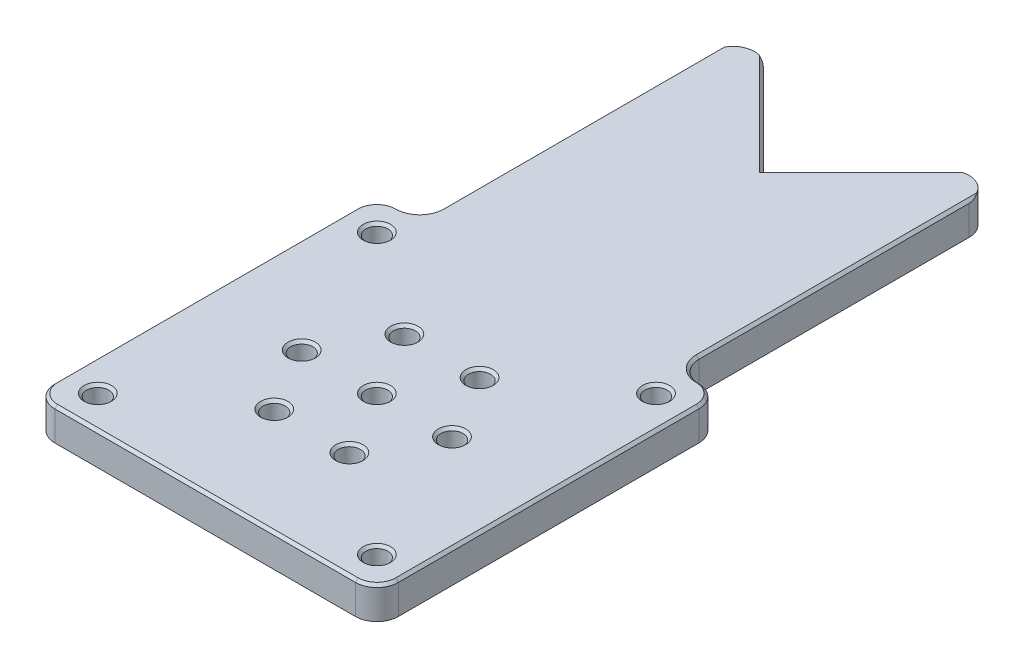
SolidWorks part; units mm, degrees
ref_plane "FRONT" through (0, 0, 0) normal (0, 0, 1) x (1, 0, 0)
ref_plane "TOP" through (0, 0, 0) normal (0, 1, 0) x (1, 0, 0)
ref_plane "RT-SIDE" through (0, 0, 0) normal (1, 0, 0) x (0, 0, -1)
sketch "Sketch1" plane through (0, 0, 0) normal (0, 0, 1) x (1, 0, 0)
  line L1 (0, 0) -> (203.2, 0)
  line L2 (0, 0) -> (0, 19.05)
  line L3 (0, 19.05) -> (203.2, 19.05)
  line L4 (203.2, 0) -> (203.2, 19.05)
  dimension "D1" = 203.2
  dimension "D2" = 19.05
extrude "Base-Extrude" add sketch "Sketch1" against normal blind 406.4
sketch "Sketch2" plane through (0, 19.05, 0) normal (0, 1, 0) x (-1, 0, 0)
  line L0 (-177.8, -406.4) -> (-177.8, -203.2)
  line L2 (-203.2, -406.4) -> (0, -406.4) construction
  line L3 (-177.8, -203.2) -> (-222.9556, -203.2)
  line L4 (-203.2, -406.4) -> (-203.2, 0) construction
  dimension "D1" = 25.4
  dimension "D2" = 203.2
extrude "Cut-Extrude2" cut sketch "Sketch2" against normal through all and the other way through all
sketch "Sketch3" plane through (0, 19.05, 0) normal (0, 1, 0) x (-1, 0, 0)
  line L0 (-25.4, -406.4) -> (-25.4, -203.2)
  line L1 (-177.8, -406.4) -> (0, -406.4) construction
  line L2 (-25.4, -203.2) -> (8.7892, -203.2)
  line L3 (0, -406.4) -> (0, 0) construction
  dimension "D1" = 25.4
  dimension "D2" = 203.2
extrude "Cut-Extrude3" cut sketch "Sketch3" against normal through all and the other way through all flip side to cut
sketch "Sketch5" plane through (0, 19.05, 0) normal (0, 1, 0) x (-1, 0, 0)
  line L0 (0, -203.2) -> (0, 0) construction
  line L1 (-203.2, 0) -> (0, 0) construction
  circle A0 centre (-19.05, -184.15) radius 6.5405
  circle A1 centre (-184.15, -184.15) radius 6.5405
  circle A2 centre (-184.15, -19.05) radius 6.5405
  circle A3 centre (-19.05, -19.05) radius 6.5405
  dimension "D1" = 13.081
  dimension "D4" = 13.081
  dimension "D7" = 13.081
  dimension "D10" = 13.081
  dimension "D2" = 19.05
  dimension "D3" = 184.15
  dimension "D5" = 165.1
  dimension "D6" = 184.15
  dimension "D8" = 165.1
  dimension "D9" = 165.1
  dimension "D11" = 165.1
  dimension "D12" = 165.1
extrude "Cut-Extrude5" cut sketch "Sketch5" against normal through all
sketch "Sketch6" plane through (0, 19.05, 0) normal (0, 1, 0) x (-1, 0, 0)
  line L0 (0, -203.2) -> (0, 0) construction
  line L1 (-203.2, 0) -> (0, 0) construction
  circle A0 centre (-101.6, -101.6) radius 6.5405
  dimension "D3" = 13.081
  dimension "D1" = 101.6
  dimension "D2" = 101.6
extrude "Cut-Extrude6" cut sketch "Sketch6" against normal through all
sketch "Sketch7" plane through (0, 19.05, 0) normal (0, 1, 0) x (-1, 0, 0)
  circle A0 centre (-146.05, -101.6) radius 6.5405
  circle A1 centre (-101.6, -101.6) radius 6.5405 construction
  dimension "D2" = 13.081
  dimension "D1" = 44.45
extrude "Cut-Extrude7" cut sketch "Sketch7" against normal through all
pattern_circular "CirPattern1" count 6 over 360 about axis through (101.6, 0, -101.6) along (0, 1, 0) of "Cut-Extrude7"
fillet "Fillet8" radius 12.7 10 edges at (190.5, 0, -203.2) (203.2, 9.525, -203.2) (190.5, 19.05, -203.2) (177.8, 9.525, -203.2) (0, 9.525, -203.2) (12.7, 19.05, -203.2) (25.4, 9.525, -203.2) (12.7, 0, -203.2) (203.2, 9.525, 0) (0, 9.525, 0)
sketch "Sketch9" plane through (0, 19.05, 0) normal (0, 1, 0) x (-1, 0, 0)
  line L0 (-25.4, -406.4) -> (-101.6, -330.2)
  line L1 (-101.6, -330.2) -> (-177.8, -406.4)
  line L2 (-177.8, -406.4) -> (-25.4, -406.4) construction
  dimension "D1" = 45
  dimension "D2" = 45
extrude "Cut-Extrude9" cut sketch "Sketch9" against normal through all and the other way through all
chamfer "Chamfer2" distance 1.5748 angle 45 24 edges at (21.6803, 19.05, -206.9197) (181.5197, 19.05, -206.9197) (139.7, 19.05, -368.3) (63.5, 19.05, -368.3) (19.05, 19.05, -177.6095) (184.15, 19.05, -177.6095) (184.15, 19.05, -12.5095) (19.05, 19.05, -12.5095) (101.6, 19.05, -95.0595) (146.05, 19.05, -95.0595) (129.4892, 19.05, -136.8246) (85.0392, 19.05, -143.3651) (57.15, 19.05, -108.1405) (73.7108, 19.05, -66.3754) (118.1608, 19.05, -59.8349) (101.6, 19.05, 0) (25.4, 19.05, -311.15) (0, 19.05, -101.6) (203.2, 19.05, -101.6) (177.8, 19.05, -311.15) (3.7197, 19.05, -199.4803) (199.4803, 19.05, -199.4803) (3.7197, 19.05, -3.7197) (199.4803, 19.05, -3.7197)
fillet "Fillet10" radius 12.7 2 edges at (25.4, 8.7376, -406.4) (177.8, 8.7376, -406.4)
